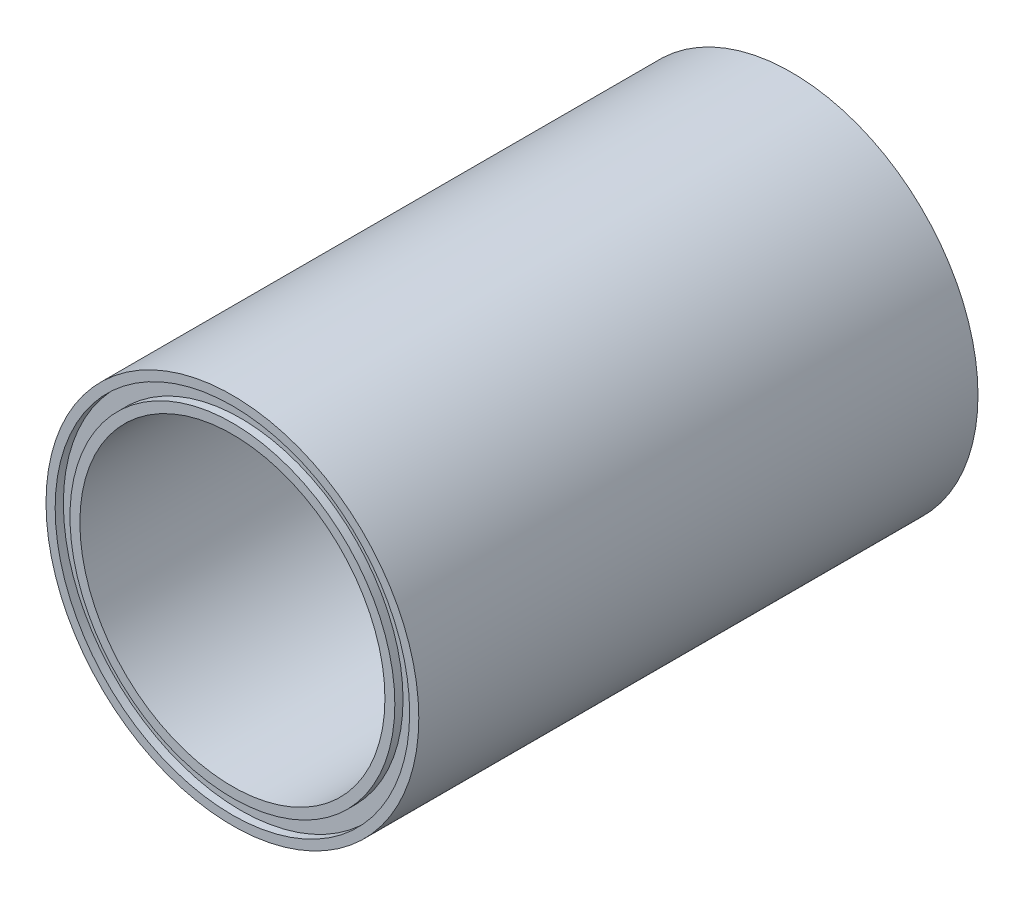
SolidWorks part; units mm, degrees
ref_plane "Front Plane" through (0, 0, 0) normal (0, 0, 1) x (1, 0, 0)
ref_plane "Top Plane" through (0, 0, 0) normal (0, 1, 0) x (1, 0, 0)
ref_plane "Right Plane" through (0, 0, 0) normal (1, 0, 0) x (0, 0, -1)
sketch "Sketch1" plane through (0, 0, 0) normal (0, 0, 1) x (1, 0, 0)
  circle A0 centre (0, 0) radius 44.45
  circle A1 centre (0, 0) radius 36.3728
  dimension "D1" = 72.7456
  dimension "D2" = 88.9
extrude "Boss-Extrude1" add sketch "Sketch1" along normal mid plane 133.35
sketch "Sketch2" plane through (0, 0, 0) normal (0, 0, 1) x (1, 0, 0)
  line L1 (0, 0) -> (47.6434, 0)
  line L2 (0, 0) -> (0, 48.0115)
  line L3 (0, 48.0115) -> (47.6434, 48.0115)
  line L4 (47.6434, 0) -> (47.6434, 48.0115)
extrude "Cut-Extrude2" [suppressed] cut sketch "Sketch2" along normal through all flip side to cut
sketch "Sketch3" plane through (0, 0, 66.675) normal (0, 0, 1) x (1, 0, 0)
  circle A0 centre (0, 0) radius 42.2656
  circle A1 centre (0, 0) radius 38.735
  dimension "D1" = 77.47
  dimension "D2" = 3.5306
extrude "Cut-Extrude3" cut sketch "Sketch3" against normal blind 1.9558
mirror "Mirror1" about plane through (0, 0, 0) normal (0, 0, 1) of "Cut-Extrude3"
